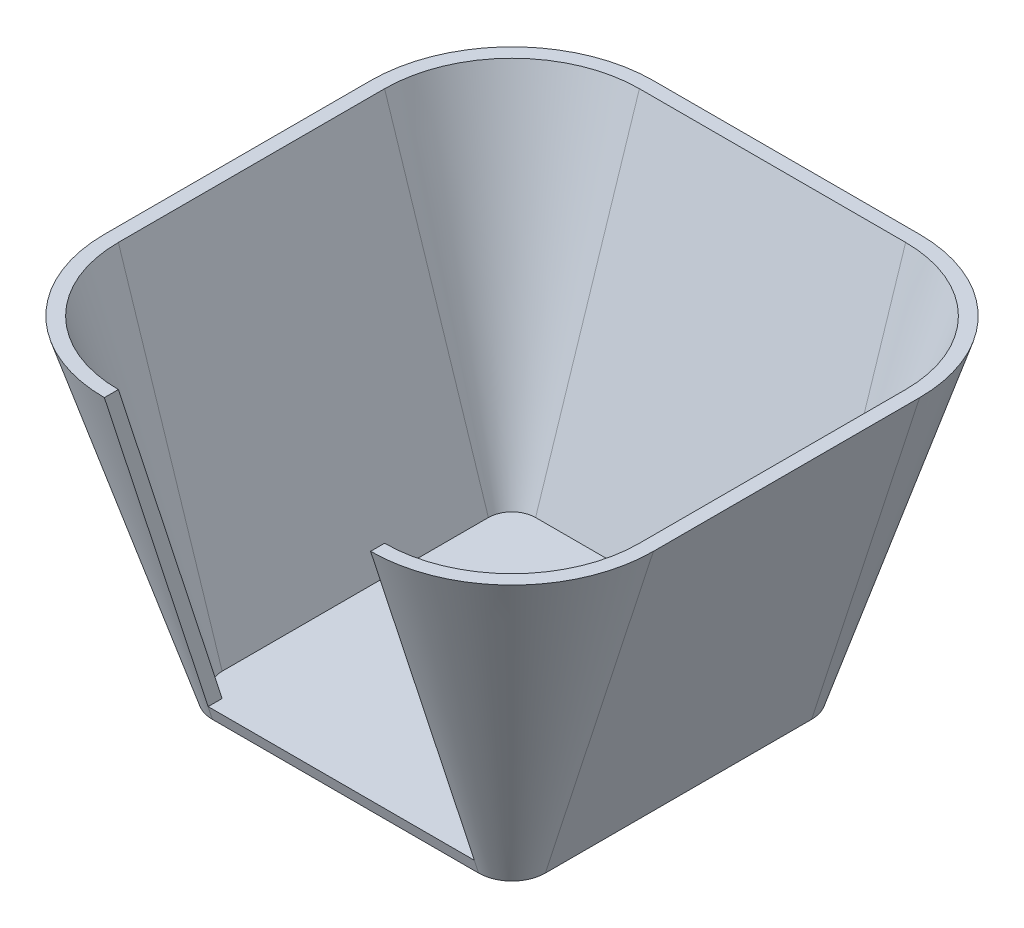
SolidWorks part; units mm, degrees
ref_plane "Front Plane" through (0, 0, 0) normal (0, 0, 1) x (1, 0, 0)
ref_plane "Top Plane" through (0, 0, 0) normal (0, 1, 0) x (1, 0, 0)
ref_plane "Right Plane" through (0, 0, 0) normal (1, 0, 0) x (0, 0, -1)
sketch "Sketch1" plane through (0, 0, 0) normal (0, 1, 0) x (1, 0, 0)
  line L0 (-25, 25) -> (25, -25) construction
  line L1 (-20, 25) -> (20, 25)
  line L2 (-25, 20) -> (-25, -20)
  line L3 (-20, -25) -> (20, -25)
  line L4 (25, 20) -> (25, -20)
  arc A0 (-20, 25) -> (-25, 20) centre (-20, 20) ccw
  arc A1 (20, 25) -> (25, 20) centre (20, 20) cw
  arc A2 (20, -25) -> (25, -20) centre (20, -20) ccw
  arc A3 (-25, -20) -> (-20, -25) centre (-20, -20) ccw
  point P10 (25, 25)
  point P16 (-25, -25)
  dimension "D3" = 5
  dimension "D1" = 50
  dimension "D2" = 50
extrude "Extrude1" add sketch "Sketch1" along normal blind 50 draft 18
shell "Shell1" thickness 2
